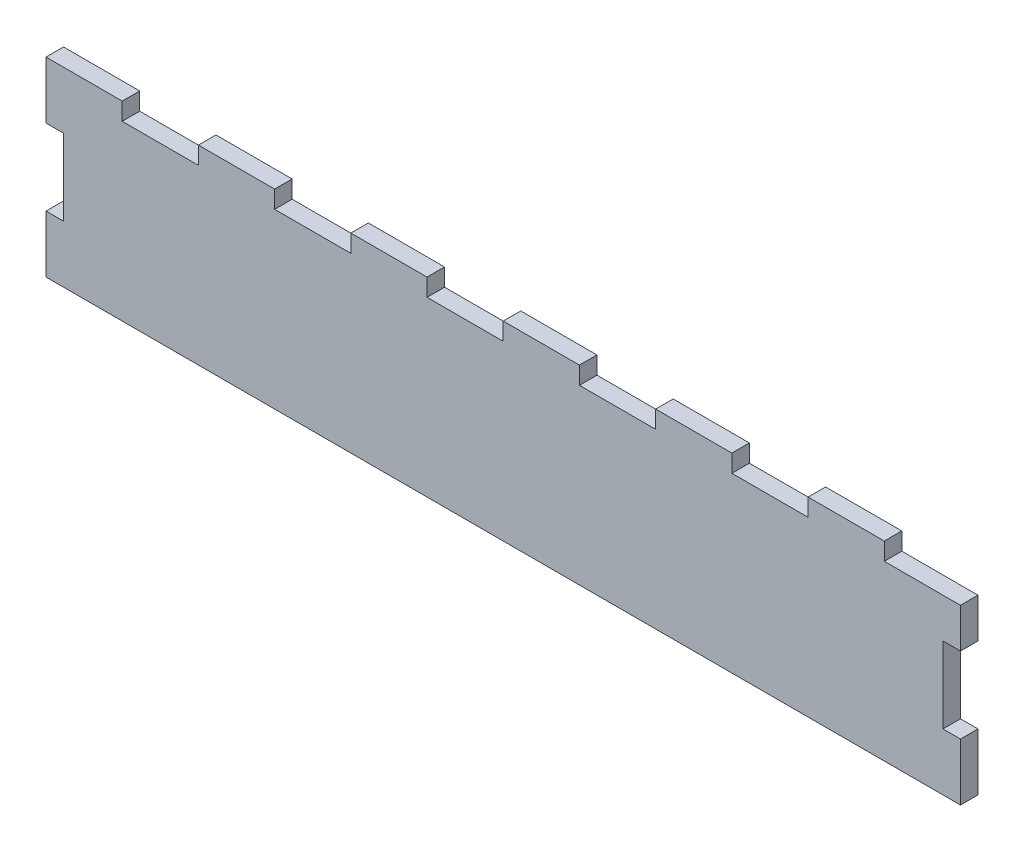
SolidWorks part; units mm, degrees
ref_plane "Front Plane" through (0, 0, 0) normal (0, 0, 1) x (1, 0, 0)
ref_plane "Top Plane" through (0, 0, 0) normal (0, 1, 0) x (1, 0, 0)
ref_plane "Right Plane" through (0, 0, 0) normal (1, 0, 0) x (0, 0, -1)
sketch "Sketch1" plane through (0, 0, 0) normal (0, 0, 1) x (1, 0, 0)
  line L0 (-279.4, 63.5) -> (-279.4, 57.658)
  line L1 (0, 0) -> (-304.8, 0)
  line L2 (0, 0) -> (0, 19.05)
  line L3 (-25.4, 63.5) -> (-50.8, 63.5)
  line L4 (-304.8, 0) -> (-304.8, 19.05)
  line L5 (-279.4, 57.658) -> (-254, 57.658)
  line L6 (-254, 57.658) -> (-254, 63.5)
  line L7 (-279.4, 63.5) -> (-304.8, 63.5)
  line L8 (-228.6, 63.5) -> (-228.6, 57.658)
  line L9 (-228.6, 57.658) -> (-203.2, 57.658)
  line L10 (-203.2, 57.658) -> (-203.2, 63.5)
  line L11 (-177.8, 63.5) -> (-177.8, 57.658)
  line L12 (-177.8, 57.658) -> (-152.4, 57.658)
  line L13 (-152.4, 57.658) -> (-152.4, 63.5)
  line L14 (-127, 63.5) -> (-127, 57.658)
  line L15 (-127, 57.658) -> (-101.6, 57.658)
  line L16 (-101.6, 57.658) -> (-101.6, 63.5)
  line L17 (-76.2, 63.5) -> (-76.2, 57.658)
  line L18 (-76.2, 57.658) -> (-50.8, 57.658)
  line L19 (-50.8, 57.658) -> (-50.8, 63.5)
  line L20 (-25.4, 63.5) -> (-25.4, 57.658)
  line L21 (-25.4, 57.658) -> (0, 57.658)
  line L22 (-304.8, 44.45) -> (-298.958, 44.45)
  line L23 (-228.6, 63.5) -> (-254, 63.5)
  line L24 (-177.8, 63.5) -> (-203.2, 63.5)
  line L25 (-127, 63.5) -> (-152.4, 63.5)
  line L26 (-76.2, 63.5) -> (-101.6, 63.5)
  line L27 (0, 57.658) -> (0, 63.5)
  line L28 (-298.958, 44.45) -> (-298.958, 19.05)
  line L29 (-298.958, 19.05) -> (-304.8, 19.05)
  line L30 (-304.8, 44.45) -> (-304.8, 63.5)
  line L31 (-152.4, 0) -> (-152.4, 14.2902) construction
  line L32 (0, 44.45) -> (0, 57.658)
  line L33 (-5.842, 19.05) -> (0, 19.05)
  line L34 (-5.842, 44.45) -> (-5.842, 19.05)
  line L35 (0, 44.45) -> (-5.842, 44.45)
  dimension "D1" = 63.5
  dimension "D2" = 304.8
  dimension "D3" = 25.4
  dimension "D4" = 25.4
  dimension "D5" = 5.842
  dimension "D7" = 5.842
  dimension "D8" = 25.4
  dimension "D9" = 19.05
  dimension "D6" = 6
extrude "Boss-Extrude1" add sketch "Sketch1" along normal blind 5.842
